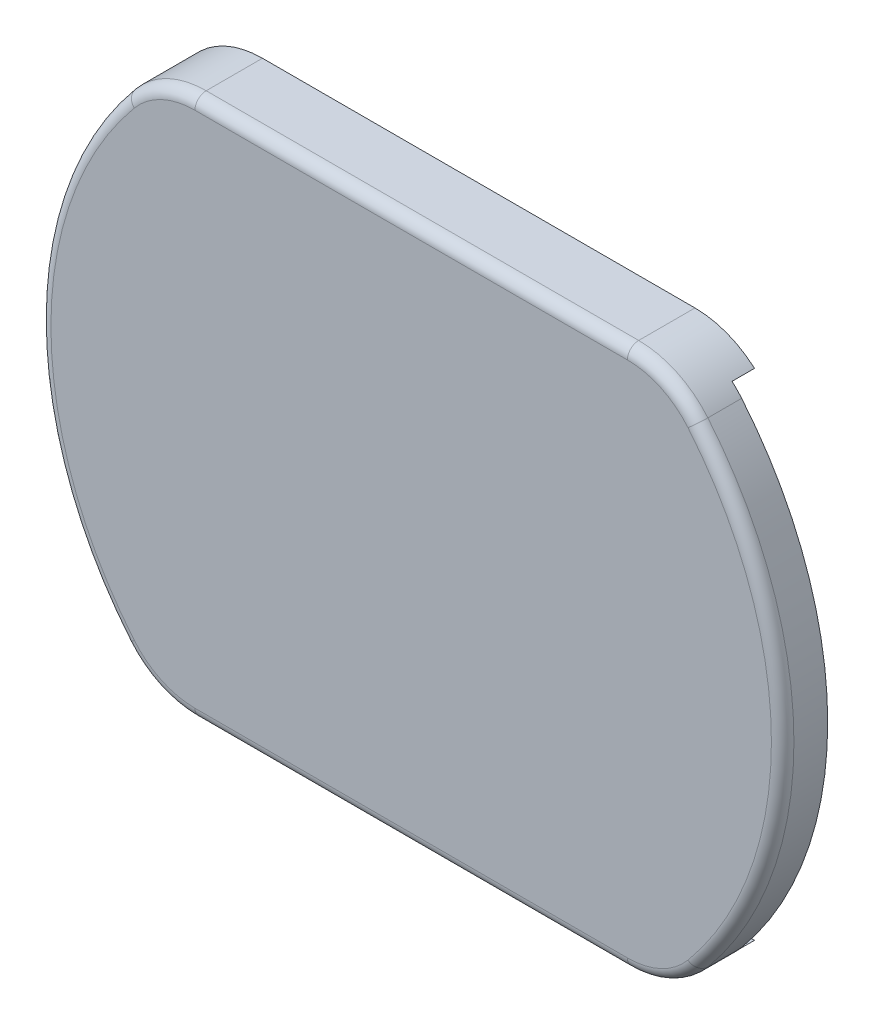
SolidWorks part; units mm, degrees
ref_plane "Front Plane" through (0, 0, 0) normal (0, 0, 1) x (1, 0, 0)
ref_plane "Top Plane" through (0, 0, 0) normal (0, 1, 0) x (1, 0, 0)
ref_plane "Right Plane" through (0, 0, 0) normal (1, 0, 0) x (0, 0, -1)
sketch "Sketch1" plane through (0, 0, 0) normal (0, 0, 1) x (1, 0, 0)
  line L0 (0, 12) -> (0, -12) construction
  line L4 (-9.6047, -12) -> (9.6047, -12)
  line L5 (9.6047, 12) -> (-9.6047, 12)
  arc A13 (-12.6782, -10.56) -> (-9.6047, -12) centre (-9.6047, -8) ccw
  arc A14 (9.6047, -12) -> (12.6782, -10.56) centre (9.6047, -8) ccw
  arc A15 (-12.6782, 10.56) -> (-12.6782, -10.56) centre (0, 0) ccw
  arc A16 (-9.6047, 12) -> (-12.6782, 10.56) centre (-9.6047, 8) ccw
  arc A17 (12.6782, -10.56) -> (12.6782, 10.56) centre (0, 0) ccw
  arc A18 (12.6782, 10.56) -> (9.6047, 12) centre (9.6047, 8) ccw
  point P13 (8.3983, 17.228)
  point P16 (-11.3248, -12)
  point P18 (11.3248, -12)
  point P19 (11.3248, 12)
  point P20 (-11.3248, 12)
  dimension "D1" = 24
  dimension "D2" = 4
  dimension "D3" = 16.5
  dimension "D4" = 22.6495
extrude "Extrude1" add sketch "Sketch1" along normal blind 3
fillet "Fillet2" radius 0.5 8 edges at (-16.5, 0, 3) (-11.3017, 11.6222, 3) (0, 12, 3) (11.3017, 11.6222, 3) (16.5, 0, 3) (11.3017, -11.6222, 3) (0, -12, 3) (-11.3017, -11.6222, 3)
sketch "Sketch4" plane through (0, 0, 0) normal (1, 0, 0) x (0, 0, -1)
  line L1 (-0.75, 10.5) -> (-0.75, 11)
  line L3 (-0.75, 11) -> (-1, 11)
  line L5 (-1, 10.5) -> (-1, 11)
  line L6 (-0.75, 10.5) -> (-1, 10.5)
sketch "Sketch2" plane through (0, 0, 0) normal (0, 0, -1) x (-1, 0, 0)
  line L2 (9.6047, 10.5) -> (-12.7279, 10.5)
  line L3 (9.6047, -10.5) -> (-12.7279, -10.5)
  arc A0 (-12.6782, 10.56) -> (-12.6782, -10.56) centre (0, 0) ccw construction
  arc A1 (-12.7279, 10.5) -> (-12.7279, -10.5) centre (0, 0) ccw
  arc A9 (9.6047, -10.5) -> (11.5256, -9.6) centre (9.6047, -8) ccw
  arc A10 (11.5256, 9.6) -> (9.6047, 10.5) centre (9.6047, 8) ccw
  arc A11 (11.5256, -9.6) -> (11.5256, 9.6) centre (0, 0) ccw
  arc A12 (9.6047, -10.5) -> (11.5256, -9.6) centre (9.6047, -8) ccw
  arc A13 (11.5256, 9.6) -> (9.6047, 10.5) centre (9.6047, 8) ccw
  arc A14 (11.5256, -9.6) -> (11.5256, 9.6) centre (0, 0) ccw
  dimension "D1" = 1.5
extrude "Cut-Extrude1" cut sketch "Sketch2" against normal up to vertex (1 mm away)
sketch "d1mm" plane through (0, 0, 0) normal (0, 0, -1) x (-1, 0, 0)
  line L2 (-10.5, -11) -> (-10.5, 11)
  line L3 (-10.5, 11) -> (-12.2984, 11)
  line L5 (-12.2984, -11) -> (-10.5, -11)
  arc A1 (-12.2984, 11) -> (-12.2984, -11) centre (0, 0) ccw
extrude "Cut-Extrude2" cut sketch "d1mm" against normal up to surface (1 mm away)
sketch "Sketch5" plane through (10.5, 0, 0) normal (1, 0, 0) x (0, 0, -1)
  line L4 (-0.75, 10.5) -> (-0.75, 11)
  line L5 (-0.75, 11) -> (-1, 11)
  line L6 (-1, 11) -> (-1, 10.5)
  line L7 (-1, 10.5) -> (-0.75, 10.5)
  line L8 (-0.75, 10.5) -> (-0.75, 11)
  line L9 (-0.75, 11) -> (-1, 11)
  line L10 (-1, 11) -> (-1, 10.5)
  line L11 (-1, 10.5) -> (-0.75, 10.5)
  dimension "D1" = 0
extrude "Cut-Extrude5" cut sketch "Sketch5" against normal blind 20
mirror "Mirror3" about plane through (0, 0, 0) normal (0, 1, 0) of "Cut-Extrude5"
